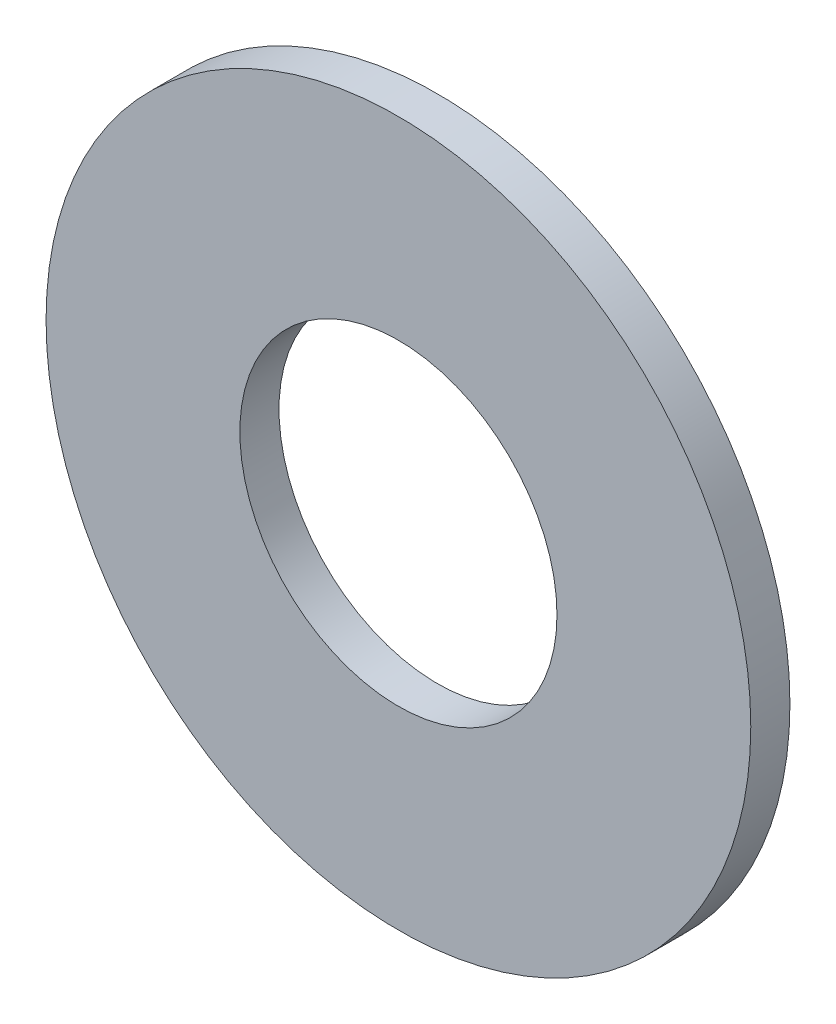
SolidWorks part; units mm, degrees
ref_plane "Face" through (0, 0, 0) normal (0, 0, 1) x (1, 0, 0)
ref_plane "Dessus" through (0, 0, 0) normal (0, 1, 0) x (1, 0, 0)
ref_plane "Droite" through (0, 0, 0) normal (1, 0, 0) x (0, 0, -1)
sketch "Esquisse1" plane through (0, 0, 0) normal (0, 0, 1) x (1, 0, 0)
  circle A0 centre (0, 0) radius 9
  circle A1 centre (0, 0) radius 4.05
  dimension "D1" = 8.1
  dimension "D2" = 18
extrude "Extrusion1" add sketch "Esquisse1" along normal blind 1
